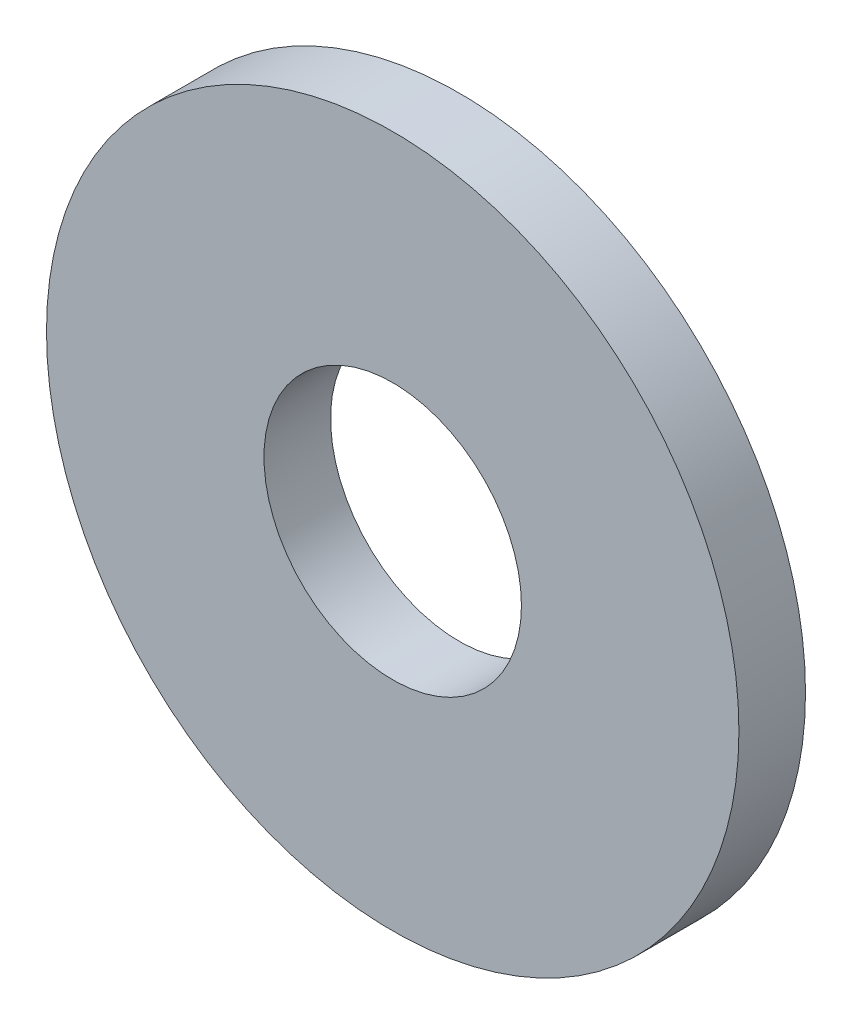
SolidWorks part; units mm, degrees
ref_plane "Front Plane" through (0, 0, 0) normal (0, 0, 1) x (1, 0, 0)
ref_plane "Top Plane" through (0, 0, 0) normal (0, 1, 0) x (1, 0, 0)
ref_plane "Right Plane" through (0, 0, 0) normal (1, 0, 0) x (0, 0, -1)
sketch "Sketch1" plane through (0, 0, 0) normal (0, 0, 1) x (1, 0, 0)
  circle A0 centre (0, 0) radius 3.9624
  dimension "D1" = 7.9248
extrude "Boss-Extrude1" add sketch "Sketch1" along normal blind 0.762
hole_wizard "#4 Clearance Hole1" positions "Sketch3" profile "Sketch2" hole size "#4" standard "ANSI Inch"
sketch "Sketch3" plane through (0, 0, 0.762) normal (0, 0, 1) x (1, 0, 0)
  point P0 (0, 0)
sketch "Sketch2" plane through (0, 0, 0.762) normal (1, 0, 0) x (0, -1, 0)
  line L0 (0, 0) -> (0, 0.762)
  line L1 (0, 0.762) -> (1.4732, 0.762)
  line L2 (1.4732, 0.762) -> (1.4732, 0)
  line L5 (1.4732, 0) -> (0, 0)
  line L11 (0, -6.35) -> (0, 107.95) construction
  dimension "Thru Hole Dia." = 2.9464
  dimension "Thru Hole Depth" = 0.762
